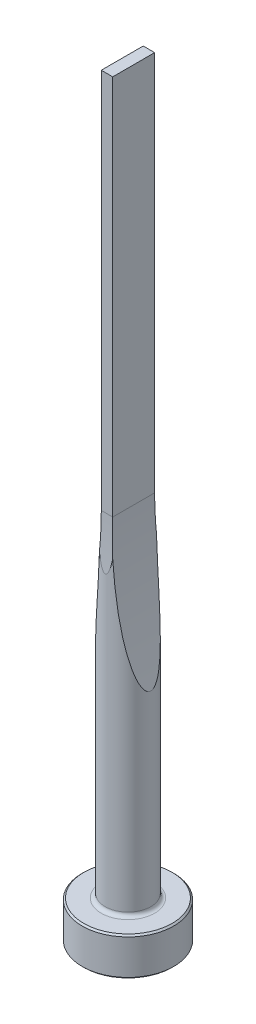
SolidWorks part; units mm, degrees
ref_plane "Front Plane" through (0, 0, 0) normal (0, 0, 1) x (1, 0, 0)
ref_plane "Top Plane" through (0, 0, 0) normal (0, 1, 0) x (1, 0, 0)
ref_plane "Right Plane" through (0, 0, 0) normal (1, 0, 0) x (0, 0, -1)
sketch "Sketch1" plane through (0, 0, 0) normal (0, 0, 1) x (1, 0, 0)
  line L0 (0, 0) -> (5.8, 0)
  line L1 (55, 0) -> (-55, 0) construction
  line L2 (6, 0.2) -> (6, 4.8)
  line L3 (5.8, 5) -> (3.5, 5)
  line L4 (3, 5.5) -> (3, 100)
  line L5 (0, 100) -> (3, 100)
  line L6 (6, 4.8) -> (5.8, 5)
  line L7 (5.8, 0) -> (6, 0.2)
  line L8 (0, 100) -> (0, 0)
  arc A0 (3, 5.5) -> (3.5, 5) centre (3.5, 5.5) ccw
  point P1 (6, 0)
  point P6 (6, 5)
  dimension "D4" = 0.5
  dimension "D1" = 3
  dimension "D2" = 6
  dimension "D3" = 5
  dimension "D5" = 100
revolve "Revolve1" add sketch "Sketch1" angle 360 about L8
sketch "Sketch2" plane through (0, 0, 0) normal (0, 0, 1) x (1, 0, 0)
  line L0 (0.75, 100) -> (0.75, 50)
  line L1 (3, 100) -> (-3, 100) construction
  line L2 (-0.75, 100) -> (-0.75, 50)
  line L3 (3, 100) -> (3, 30.0016)
  line L4 (-3, 100) -> (-3, 30.0016)
  line L5 (0, -6.6) -> (0, 6.6) construction
  line L6 (3, 100) -> (0.75, 100)
  line L8 (-0.75, 100) -> (-3, 100)
  arc A0 (0.75, 50) -> (3, 30.0016) centre (90.75, 50) ccw
  arc A1 (-0.75, 50) -> (-3, 30.0016) centre (-90.75, 50) cw
  dimension "D4" = 90
  dimension "D1" = 50
  dimension "D2" = 1.5
  dimension "D3" = 0.75
extrude "Cut-Extrude1" cut sketch "Sketch2" against normal mid plane 10
sketch "Sketch3" plane through (0, 0, 0) normal (1, 0, 0) x (0, 0, -1)
  line L0 (2.75, 100) -> (2.75, 50)
  line L1 (-2.9047, 100) -> (2.9047, 100) construction
  line L2 (-2.75, 100) -> (-2.75, 50)
  line L3 (3, 100) -> (3, 43.2965)
  line L4 (2.75, 100) -> (3, 100)
  line L5 (0, 6.6) -> (0, -6.6) construction
  line L6 (-3, 100) -> (-3, 43.2965)
  line L8 (-2.75, 100) -> (-3, 100)
  arc A0 (2.75, 50) -> (3, 43.2965) centre (92.75, 50) ccw
  arc A1 (-2.75, 50) -> (-3, 43.2965) centre (-92.75, 50) cw
  dimension "D2" = 90
  dimension "D1" = 50
  dimension "D3" = 5.5
  dimension "D4" = 2.75
extrude "Cut-Extrude2" cut sketch "Sketch3" against normal mid plane 10
